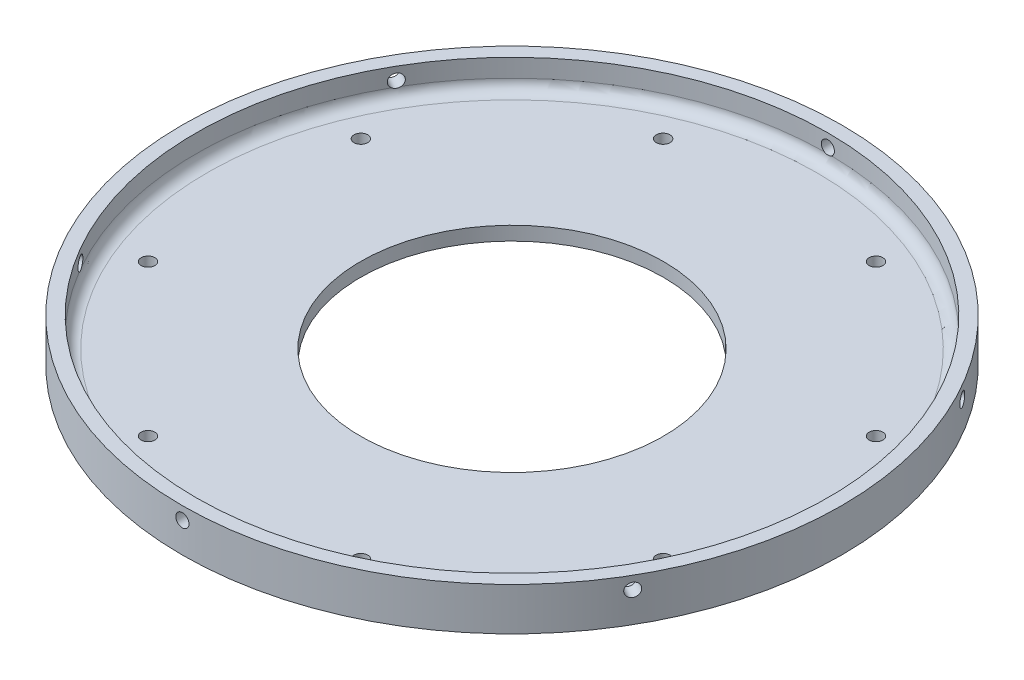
SolidWorks part; units mm, degrees
ref_plane "Front Plane" through (0, 0, 0) normal (0, 0, 1) x (1, 0, 0)
ref_plane "Top Plane" through (0, 0, 0) normal (0, 1, 0) x (1, 0, 0)
ref_plane "Right Plane" through (0, 0, 0) normal (1, 0, 0) x (0, 0, -1)
sketch "Sketch5" plane through (0, 0, 0) normal (0, 0, 1) x (1, 0, 0)
  line L0 (0, -81.0912) -> (0, 91.6745) construction
  line L1 (-176.4413, 0) -> (90.7126, 0) construction
  line L2 (-35, 0) -> (-76.2, 0)
  line L3 (-35, 0) -> (-35, 3.175)
  line L4 (-35, 3.175) -> (-73.025, 3.175)
  line L7 (-76.2, 0) -> (-76.2, 9.9)
  line L8 (-76.2, 9.9) -> (-73.025, 9.9)
  line L9 (-73.025, 3.175) -> (-73.025, 9.9)
  dimension "D1" = 41.2
  dimension "D2" = 3.175
  dimension "D3" = 9.9
  dimension "D4" = 3.175
  dimension "D6" = 35
revolve "Revolve1" add sketch "Sketch5" angle 360 about L0
fillet "Fillet1" radius 2.54 1 edges at (0, 3.175, -73.025)
sketch "Sketch7" plane through (0, 0, 0) normal (0, 0, 1) x (1, 0, 0)
  circle A0 centre (0.0103, 6.985) radius 0.6
  dimension "D1" = 6.985
hole_wizard "#31 (0.12) Diameter Hole1" positions "Sketch9" profile "Sketch10" hole size "#31" standard "ANSI Inch"
sketch "Sketch9" plane through (0, 0, 0) normal (0, 0, 1) x (1, 0, 0)
  point P0 (0.0103, 6.985)
sketch "Sketch10" plane through (0.0103, 6.985, 0) normal (1, 0, 0) x (0, 1, 0)
  line L0 (0, 0) -> (0, 104.0911)
  line L1 (0, 104.0911) -> (1.524, 104.0911)
  line L2 (1.524, 104.0911) -> (1.524, 0)
  line L5 (1.524, 0) -> (0, 0)
  line L11 (0, -6.35) -> (0, 107.95) construction
  dimension "Thru Hole Dia." = 3.048
  dimension "Thru Hole Depth" = 104.0911
pattern_circular "CirPattern1" count 6 over 360 about axis through (0, -81.0912, 0) along (0, -1, 0) of "#31 (0.12) Diameter Hole1"
sketch "Sketch11" plane through (0, 3.175, 0) normal (0, 1, 0) x (1, 0, 0)
  line L0 (-50, 50) -> (50, 50) construction
  line L1 (-50, 50) -> (-50, -50) construction
  line L2 (-50, -50) -> (50, -50) construction
  line L3 (50, -50) -> (50, 50) construction
  line L4 (-24.6, 50) -> (-24.6, 59.525) construction
  line L5 (24.6, 50) -> (24.6, 59.525) construction
  line L6 (50, 50) -> (-50, -50) construction
  line L7 (-50, 50) -> (50, -50) construction
  line L8 (-24.6, -50) -> (-24.6, -59.525) construction
  line L9 (24.6, -50) -> (24.6, -59.525) construction
  line L10 (-50, 24.6) -> (-59.525, 24.6) construction
  line L11 (-50, -24.6) -> (-59.525, -24.6) construction
  line L12 (50, 24.6) -> (59.525, 24.6) construction
  line L13 (50, -24.6) -> (59.525, -24.6) construction
  dimension "D1" = 25.4
  dimension "D2" = 25.4
  dimension "D3" = 9.525
  dimension "D4" = 9.525
  dimension "D5" = 100
  dimension "D6" = 25.4
  dimension "D7" = 25.4
  dimension "D8" = 9.525
  dimension "D9" = 9.525
  dimension "D10" = 9.525
  dimension "D11" = 9.525
hole_wizard "1/8 (0.125) Diameter Hole1" positions "Sketch16" profile "Sketch15" hole size "1/8" standard "ANSI Inch"
sketch "Sketch16" plane through (0, 0, 0) normal (0, 1, 0) x (1, 0, 0)
  point P0 (-24.6, 59.525)
  point P3 (24.6, 59.525)
  point P6 (-59.525, 24.6)
  point P9 (-59.525, -24.6)
  point P12 (-24.6, -59.525)
  point P15 (24.6, -59.525)
  point P18 (59.525, -24.6)
  point P21 (59.525, 24.6)
sketch "Sketch15" plane through (-24.6, 0, -59.525) normal (1, 0, 0) x (0, 0, -1)
  line L0 (0, 0) -> (0, 9.9)
  line L1 (0, 9.9) -> (1.5875, 9.9)
  line L2 (1.5875, 9.9) -> (1.5875, 0)
  line L5 (1.5875, 0) -> (0, 0)
  line L11 (0, -6.35) -> (0, 107.95) construction
  dimension "Thru Hole Dia." = 3.175
  dimension "Thru Hole Depth" = 9.9
